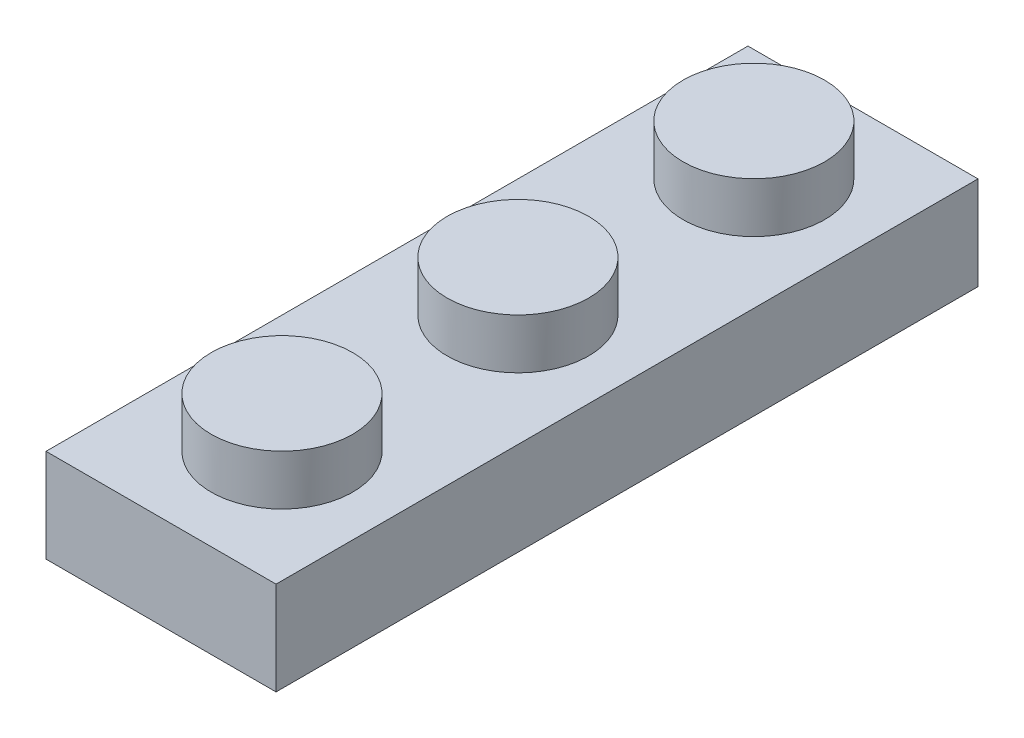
SolidWorks part; units mm, degrees
ref_plane "Front Plane" through (0, 0, 0) normal (0, 0, 1) x (1, 0, 0)
ref_plane "Top Plane" through (0, 0, 0) normal (0, 1, 0) x (1, 0, 0)
ref_plane "Right Plane" through (0, 0, 0) normal (1, 0, 0) x (0, 0, -1)
sketch "Sketch1" plane through (0, 0, 0) normal (0, 1, 0) x (1, 0, 0)
  line L1 (0, 0) -> (7.8, 0)
  line L2 (0, 0) -> (0, 23.8)
  line L3 (0, 23.8) -> (7.8, 23.8)
  line L4 (7.8, 0) -> (7.8, 23.8)
  dimension "D1" = 7.8
  dimension "D2" = 23.8
extrude "Extrude1" add sketch "Sketch1" along normal blind 3.166
sketch "Sketch2" plane through (0, 3.166, 0) normal (0, 1, 0) x (1, 0, 0)
  circle A0 centre (4, 4) radius 2.4
  point P6 (9.3567, 6.1688)
  dimension "D1" = 4.8
extrude "Extrude2" add sketch "Sketch2" along normal blind 1.7
sketch "Sketch3" plane through (0, 0, 0) normal (0, -1, 0) x (1, 0, 0)
  line L0 (7.8, 0) -> (7.8, -23.8) construction
  line L1 (1.45, -17.45) -> (6.35, -17.45)
  line L2 (1.45, -17.45) -> (1.45, -22.35)
  line L3 (1.45, -22.35) -> (6.35, -22.35)
  line L4 (6.35, -17.45) -> (6.35, -22.35)
  line L5 (7.8, -23.8) -> (0, -23.8) construction
  dimension "D1" = 4.9
  dimension "D2" = 1.45
  dimension "D3" = 1.45
extrude "Extrude3" cut sketch "Sketch3" against normal blind 2.5
sketch "Sketch4" plane through (0, 3.166, 0) normal (0, 1, 0) x (1, 0, 0)
  line L0 (3.9, 0) -> (3.9, 16.3566) construction
  line L1 (0, 0) -> (7.8, 0) construction
pattern_linear "LPattern1" count 2 spacing 8 along (0, 0, -1) of "Extrude2"
pattern_linear "LPattern2" count 2 spacing 8 along (0, 0, 1) of "Extrude3"
pattern_linear "LPattern3" count 3 spacing 8 along (0, 0, -1) of "Extrude2"
pattern_linear "LPattern4" count 2 spacing 8 along (0, 0, 1) of "LPattern2"
